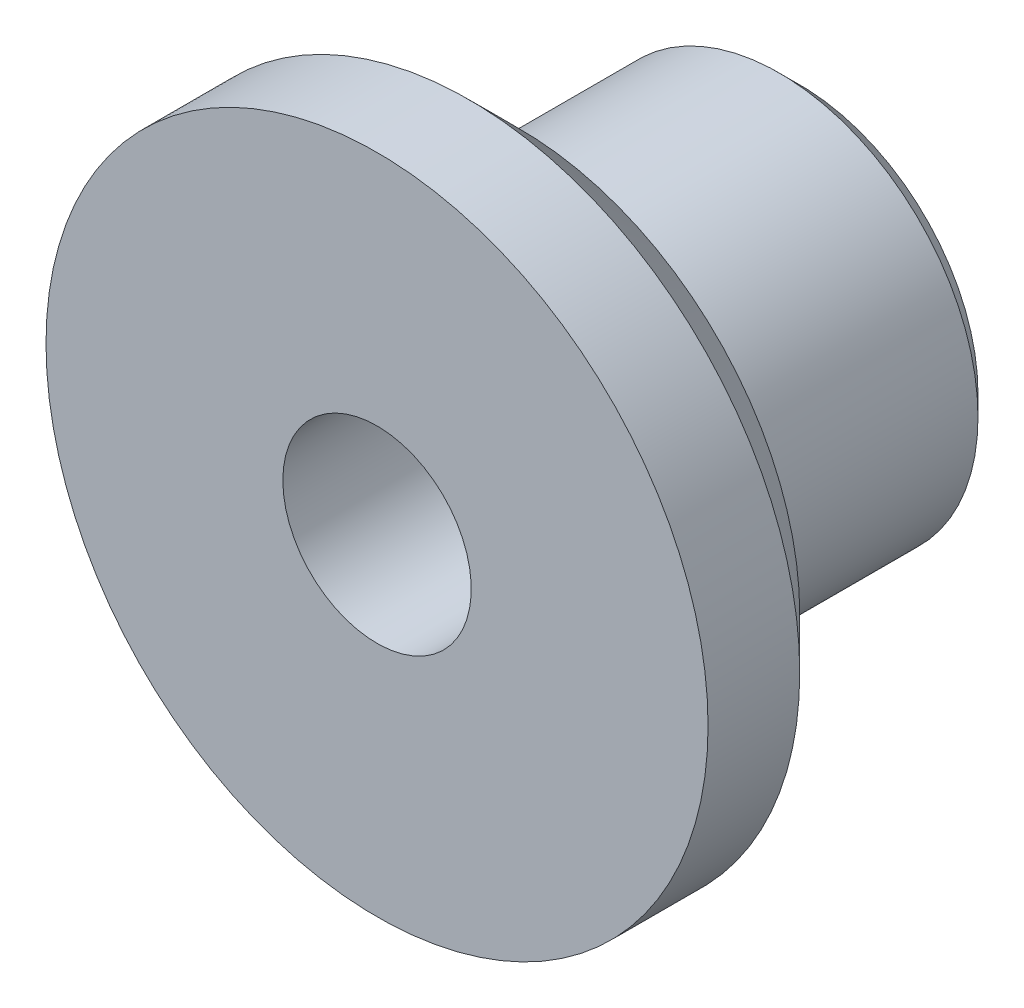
SolidWorks part; units mm, degrees
ref_plane "Front Plane" through (0, 0, 0) normal (0, 0, 1) x (1, 0, 0)
ref_plane "Top Plane" through (0, 0, 0) normal (0, 1, 0) x (1, 0, 0)
ref_plane "Right Plane" through (0, 0, 0) normal (1, 0, 0) x (0, 0, -1)
sketch "Sketch1" plane through (0, 0, 0) normal (0, 0, 1) x (1, 0, 0)
  circle A0 centre (0, 0) radius 3.9
  circle A1 centre (0, 0) radius 1.85
  dimension "D1" = 7.8
  dimension "D2" = 3.7
extrude "Boss-Extrude1" add sketch "Sketch1" along normal blind 8.3
sketch "Sketch2" plane through (0, 0, 8.3) normal (0, 0, 1) x (1, 0, 0)
  circle A0 centre (0, 0) radius 6.5
  dimension "D1" = 13
extrude "Boss-Extrude2" add sketch "Sketch2" against normal offset from surface (2.8 mm away) 5.5
chamfer "Chamfer1" distance 1 angle 45 1 edges at (6.5, 0, 5.5)
sketch "Sketch3" plane through (0, 0, 8.3) normal (0, 0, 1) x (1, 0, 0)
  circle A0 centre (0, 0) radius 1.85
  dimension "D1" = 3.7
extrude "Cut-Extrude1" cut sketch "Sketch3" against normal through all
chamfer "Chamfer2" distance 0.4 angle 45 2 edges at (3.9, 0, 0) (1.85, 0, 0)
chamfer "Chamfer3" distance 0.2 angle 45 1 edges at (3.9, 0, 5.5)
equation "\"D1@Sketch3\"=\"D2@Sketch1\""
